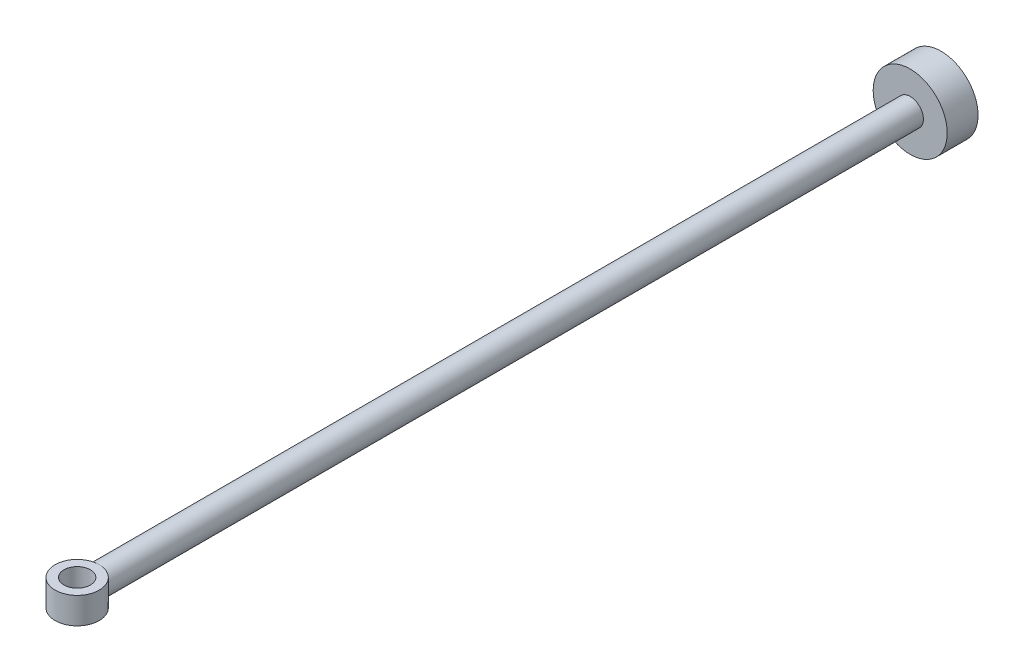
SolidWorks part; units mm, degrees
ref_plane "Plan de face" through (0, 0, 0) normal (0, 0, 1) x (1, 0, 0)
ref_plane "Plan de dessus" through (0, 0, 0) normal (0, 1, 0) x (1, 0, 0)
ref_plane "Plan de droite" through (0, 0, 0) normal (1, 0, 0) x (0, 0, -1)
sketch "Esquisse1" plane through (0, 0, 0) normal (0, 0, 1) x (1, 0, 0)
  circle A0 centre (0, 0) radius 15
  dimension "D1" = 30
extrude "Boss.-Extru.1" add sketch "Esquisse1" along normal blind 925
sketch "Esquisse2" plane through (0, 0, 0) normal (0, 0, -1) x (-1, 0, 0)
  circle A0 centre (0, 0) radius 42
  dimension "D1" = 84
extrude "Boss.-Extru.2" add sketch "Esquisse2" along normal blind 35
sketch "Esquisse3" plane through (0, 0, 0) normal (0, 1, 0) x (1, 0, 0)
  line L0 (0, -419.2823) -> (0, -583.1848) construction
  line L1 (-15, -925) -> (15, -925) construction
  circle A1 centre (0, -945) radius 25
  dimension "D2" = 50
  dimension "D3" = 20
extrude "Boss.-Extru.4" add sketch "Esquisse3" along normal mid plane 30
sketch "Esquisse5" plane through (0, -15, 0) normal (0, -1, 0) x (1, 0, 0)
  circle A0 centre (0, 945) radius 15
  circle A1 centre (0, 945) radius 25 construction
  dimension "D1" = 30
extrude "Enlèv. mat.-Extru.1" cut sketch "Esquisse5" against normal mid plane 120
sketch "Esquisse6" plane through (0, 0, 0) normal (0, 1, 0) x (1, 0, 0)
  circle A0 centre (0, -945) radius 25 construction
  point P0 (0, -945)
